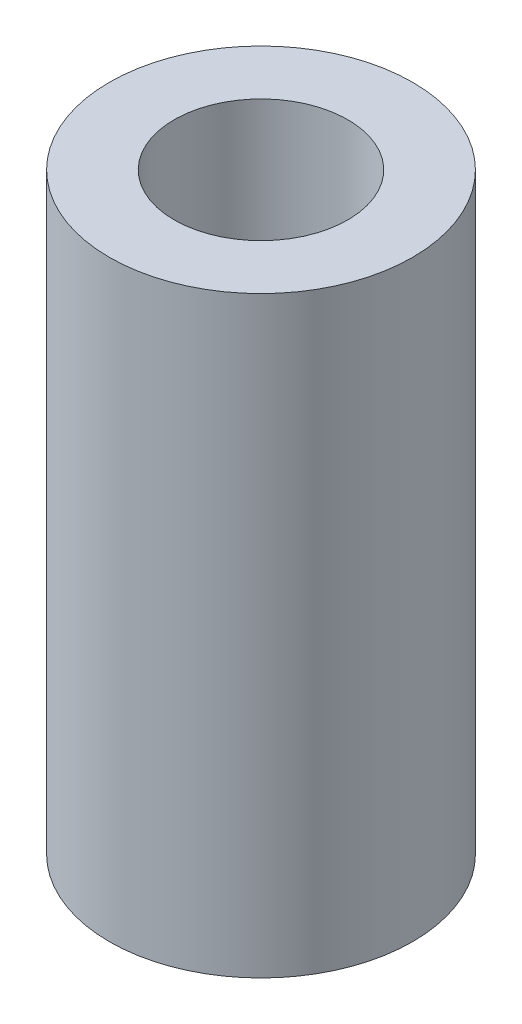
SolidWorks part; units mm, degrees
ref_plane "Front Plane" through (0, 0, 0) normal (0, 0, 1) x (1, 0, 0)
ref_plane "Top Plane" through (0, 0, 0) normal (0, 1, 0) x (1, 0, 0)
ref_plane "Right Plane" through (0, 0, 0) normal (1, 0, 0) x (0, 0, -1)
sketch "Sketch1" plane through (0, 0, 0) normal (0, 1, 0) x (1, 0, 0)
  circle A0 centre (0, 0) radius 2.794
  dimension "D1" = 5.588
extrude "Boss-Extrude1" add sketch "Sketch1" along normal blind 10.922
hole_wizard "M3 Clearance Hole1" positions "Sketch5" profile "Sketch6" hole size "M3" standard "Ansi Metric"
sketch "Sketch5" plane through (0, 10.922, 0) normal (0, 1, 0) x (-1, 0, 0)
  point P0 (0, 0)
sketch "Sketch6" plane through (0, 10.922, 0) normal (1, 0, 0) x (0, 0, 1)
  line L0 (0, 0) -> (0, 10.922)
  line L1 (0, 10.922) -> (1.6, 10.922)
  line L2 (1.6, 10.922) -> (1.6, 0)
  line L5 (1.6, 0) -> (0, 0)
  line L11 (0, -6.35) -> (0, 107.95) construction
  dimension "Thru Hole Dia." = 3.2
  dimension "Thru Hole Depth" = 10.922
